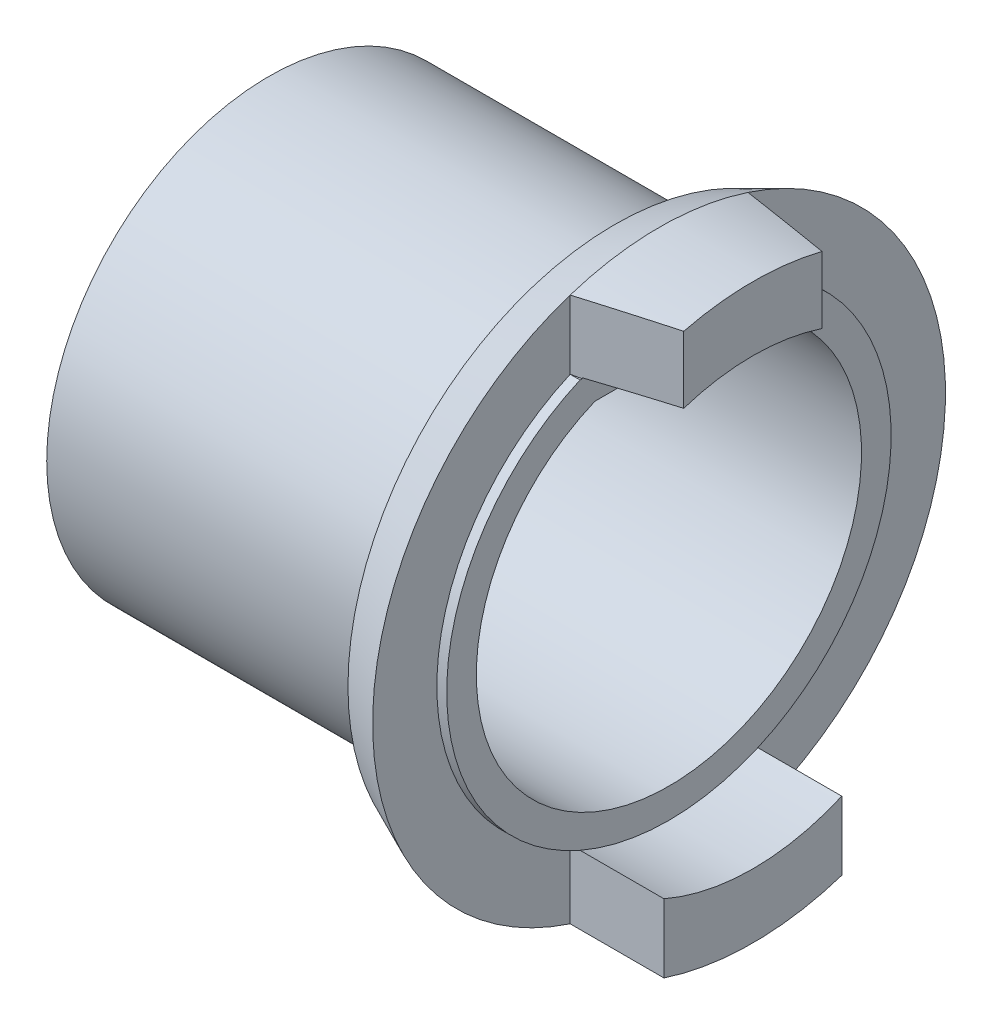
SolidWorks part; units mm, degrees
ref_plane "Plan1" through (0, 0, 0) normal (0, 0, 1) x (1, 0, 0)
ref_plane "Plan2" through (0, 0, 0) normal (0, 1, 0) x (1, 0, 0)
ref_plane "Plan3" through (0, 0, 0) normal (1, 0, 0) x (0, 0, -1)
sketch "Esquisse1" plane through (0, 0, 0) normal (0, 0, 1) x (1, 0, 0)
  line L0 (-130, 0) -> (140, 0) construction
  line L1 (26.2493, 19.5) -> (66.7493, 19.5)
  line L2 (26.2493, 22.5) -> (59.2493, 22.5)
  line L3 (61.2493, 22.4) -> (61.2493, 27)
  line L4 (59.2493, 22.4) -> (61.2493, 22.4)
  line L5 (59.2493, 22.5) -> (59.2493, 22.4)
  line L6 (65.7493, 29) -> (65.7493, 22.5)
  line L7 (26.2493, 22.5) -> (26.2493, 19.5)
  line L8 (61.2493, 27) -> (65.7493, 29)
  line L9 (65.7493, 22.5) -> (66.7493, 22.5)
  line L10 (66.7493, 22.5) -> (66.7493, 19.5)
  dimension "D1" = 19.5
  dimension "D2" = 22.5
  dimension "D3" = 22.4
  dimension "D4" = 2
  dimension "D5" = 35
  dimension "D6" = 39.5
  dimension "D7" = 1
revolve "Base-Révolution" add sketch "Esquisse1" angle 360 about L0
chamfer "Chanfrein1" distance 1.7 angle 45 1 edges at (26.2493, 0, 19.5)
ref_plane "Plan4" through (0, 29, 0) normal (0, 1, 0) x (-1, 0, 0)
sketch "Esquisse4" plane through (65.7493, 0, 0) normal (1, 0, 0) x (0, 0, -1)
  line L0 (-9, 27.5681) -> (-9, 20.6216)
  line L1 (9, 27.5681) -> (9, 20.6216)
  arc A0 (9, 20.6216) -> (-9, 20.6216) centre (0, 0) ccw
  circle A1 centre (0, 0) radius 22.5 construction
  arc A2 (9, 27.5681) -> (-9, 27.5681) centre (0, 0) ccw
  circle A3 centre (0, 0) radius 29 construction
  dimension "D1" = 9
  dimension "D2" = 9
extrude "Boss.-Extru.2" add sketch "Esquisse4" along normal blind 9.5
sketch "Esquisse5" plane through (0, 29, 0) normal (0, 1, 0) x (-1, 0, 0)
  line L1 (-65.7493, 9) -> (-75.2493, 7)
  line L2 (-75.2493, 9) -> (-75.2493, -9) construction
  line L3 (-65.7493, -9) -> (-75.2493, -7)
  line L5 (-75.2493, 0) -> (-66.7493, 0) construction
  line L7 (-65.7493, 9) -> (-75.2493, 9)
  line L8 (-75.2493, 9) -> (-75.2493, 7)
  line L9 (-75.2493, -7) -> (-75.2493, -9)
  line L10 (-75.2493, -9) -> (-65.7493, -9)
  dimension "D1" = 7
  dimension "D2" = 7
extrude "Enlèv. mat.-Extru.1" cut sketch "Esquisse5" against normal up to vertex (8.3784 mm away)
pattern_circular "Répétition circulaire1" count 2 every 180 about axis through (0, 0, 0) along (1, 0, 0) of "Boss.-Extru.2"
sketch "Esquisse6" plane through (66.7493, 0, 0) normal (1, 0, 0) x (0, 0, -1)
  line L0 (-10.8943, 18) -> (10.8943, 18)
  arc A0 (10.8943, 18) -> (-10.8943, 18) centre (0, 0) ccw
  dimension "D1" = 18
extrude "Extrusion1" add sketch "Esquisse6" against normal up to surface (40.3401 mm away)
